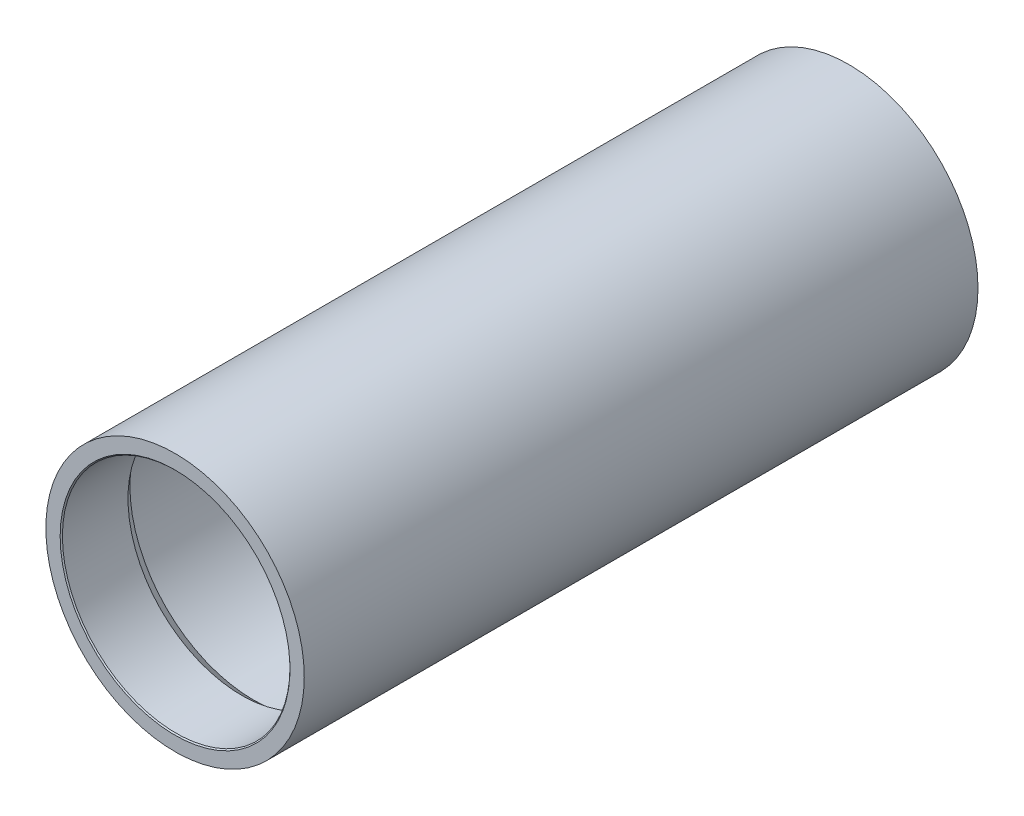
SolidWorks part; units mm, degrees
ref_plane "Front Plane" through (0, 0, 0) normal (0, 0, 1) x (1, 0, 0)
ref_plane "Top Plane" through (0, 0, 0) normal (0, 1, 0) x (1, 0, 0)
ref_plane "Right Plane" through (0, 0, 0) normal (1, 0, 0) x (0, 0, -1)
sketch "Sketch1" plane through (0, 0, 0) normal (1, 0, 0) x (0, 0, -1)
  line L0 (0, 0) -> (55596.8407, 0) construction
  line L1 (0, 57.15) -> (0, 50.325)
  line L2 (0, 50.325) -> (29.5, 50.325)
  line L3 (29.5, 50.325) -> (34.7735, 54.75)
  line L4 (34.7735, 54.75) -> (263.2265, 54.75)
  line L5 (263.2265, 54.75) -> (268.5, 50.325)
  line L6 (268.5, 50.325) -> (298, 50.325)
  line L7 (298, 50.325) -> (298, 57.15)
  line L8 (298, 57.15) -> (0, 57.15)
  dimension "D1" = 114.3
  dimension "D2" = 100.65
  dimension "D3" = 109.5
  dimension "D4" = 29.5
  dimension "D5" = 140
  dimension "D6" = 298
revolve "Revolve1" add sketch "Sketch1" angle 360 about L0
chamfer "Chamfer1" distance 0.5 angle 45 2 edges at (50.325, 0, -298) (50.325, 0, 0)
